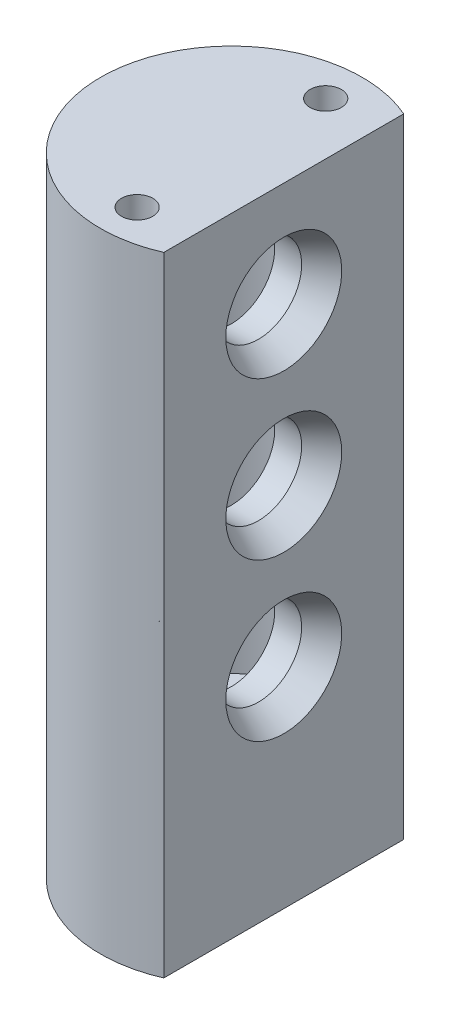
SolidWorks part; units mm, degrees
ref_plane "Front Plane" through (0, 0, 0) normal (0, 0, 1) x (1, 0, 0)
ref_plane "Top Plane" through (0, 0, 0) normal (0, 1, 0) x (1, 0, 0)
ref_plane "Right Plane" through (0, 0, 0) normal (1, 0, 0) x (0, 0, -1)
sketch "Sketch1" plane through (0, 0, 0) normal (0, 1, 0) x (1, 0, 0)
  line L0 (6.35, -14.5497) -> (6.35, 14.5497)
  circle A0 centre (0, 0) radius 16.5227 construction
  arc A1 (6.35, 14.5497) -> (6.35, -14.5497) centre (0, 0) ccw
  dimension "D1" = 33.0454
  dimension "D2" = 31.75
  dimension "D3" = 6.35
extrude "Boss-Extrude1" add sketch "Sketch1" along normal blind 76.2
ref_plane "Plane1" through (0, 15.24, 0) normal (0, 1, 0) x (1, 0, 0)
sketch "Sketch4" plane through (0, 15.24, 0) normal (0, 1, 0) x (1, 0, 0)
  line L0 (0, -8.89) -> (0, 8.89)
  arc A0 (0, 8.89) -> (0, -8.89) centre (0, 0) ccw
  dimension "D1" = 17.78
extrude "Cut-Extrude1" cut sketch "Sketch4" along normal blind 55.88
hole_wizard "M12x1.5 Tapped Hole1" positions "Sketch3" profile "Sketch2" tap size "M12x1.5" standard "ANSI Metric"
sketch "Sketch3" plane through (6.35, 0, 0) normal (1, 0, 0) x (0, 0, -1)
  line L0 (-14.5497, 76.2) -> (14.5497, 76.2) construction
  line L1 (0, 0) -> (0, 76.2) construction
  line L2 (-14.5497, 0) -> (14.5497, 0) construction
  point P0 (0, 63.5)
  point P2 (0, 44.45)
  point P4 (0, 63.5)
  point P8 (0, 76.2)
  point P25 (0, 25.4)
  dimension "D1" = 12.7
  dimension "D2" = 19.05
  dimension "D3" = 19.05
sketch "Sketch2" plane through (6.35, 63.5, 0) normal (0, 1, 0) x (0, 0, -1)
  line L0 (0, 0) -> (0, 22.225)
  line L1 (0, 22.225) -> (5.25, 22.225)
  line L2 (5.25, 22.225) -> (5.25, 0)
  line L5 (5.25, 0) -> (0, 0)
  line L11 (0, -6.35) -> (0, 107.95) construction
  dimension "Thru Tap Drill Dia." = 10.5
  dimension "Thru Tap Drill Depth" = 22.225
sketch "Sketch5" plane through (0, 0, 0) normal (0, 0, 1) x (1, 0, 0)
  line L0 (-12.4648, 72.39) -> (-12.4648, 13.97)
  line L1 (-11.1948, 12.7) -> (-1.27, 12.7)
  line L2 (-11.1948, 73.66) -> (-7.3848, 73.66)
  line L3 (-6.1148, 72.39) -> (-6.1148, 71.12)
  line L6 (0, 0) -> (0, 63.609) construction
  line L7 (0, 15.24) -> (-8.89, 15.24) construction
  line L8 (0, 10.0024) -> (0, 11.43)
  arc A0 (-11.1948, 12.7) -> (-12.4648, 13.97) centre (-11.1948, 13.97) cw
  arc A1 (-12.4648, 72.39) -> (-11.1948, 73.66) centre (-11.1948, 72.39) cw
  arc A2 (-6.1148, 72.39) -> (-7.3848, 73.66) centre (-7.3848, 72.39) ccw
  arc A3 (0, 11.43) -> (-1.27, 12.7) centre (-1.27, 11.43) ccw
  point P8 (-6.1148, 73.66)
  point P14 (-2.5135, 64.77)
  point P23 (0, 12.7)
  dimension "D2" = 1.27
  dimension "D4" = 1.27
  dimension "D6" = 1.27
  dimension "D1" = 2.54
  dimension "D3" = 2.54
  dimension "D5" = 5.08
  dimension "D7" = 58.42
ref_plane "Plane5" through (0, 71.12, 0) normal (0, -1, 0) x (-1, 0, 0)
sketch "Sketch8" plane through (0, 71.12, 0) normal (0, -1, 0) x (-1, 0, 0)
  circle A0 centre (6.1148, 0) radius 0.889
  point P0 (6.1148, 0)
  point P4 (6.1148, 0)
  dimension "D1" = 1.778
sweep "Cut-Sweep1" cut profiles "Sketch8" path "Sketch5"
sketch "Sketch12" plane through (0, 0, 0) normal (0, -1, 0) x (1, 0, 0)
  circle A0 centre (0, 0) radius 2.7051
  circle A1 centre (0, 0) radius 0.889 construction
  circle A2 centre (0, 0) radius 0.889 construction
  dimension "D1" = 5.4102
extrude "Cut-Extrude2" cut sketch "Sketch12" against normal blind 10.16
hole_wizard "CBORE for #6 Socket Head Cap Screw1" positions "Sketch11" profile "Sketch9" counterbore size "#6" standard "ANSI Inch"
sketch "Sketch11" plane through (0, 0, 0) normal (0, -1, 0) x (-1, 0, 0)
  line L0 (0, 0) -> (-6.35, 0) construction
  line L1 (-6.35, -14.5497) -> (-6.35, 14.5497) construction
  point P7 (0, -11.43)
  point P9 (0, 11.43)
  dimension "D1" = 11.43
  dimension "D2" = 6.35
sketch "Sketch9" plane through (0, 0, 11.43) normal (1, 0, 0) x (0, 0, -1)
  line L0 (0, 0) -> (0, 76.2)
  line L1 (0, 76.2) -> (1.8986, 76.2)
  line L3 (1.8986, 76.2) -> (1.8987, 10.16)
  line L4 (3.5725, 10.16) -> (1.8987, 10.16)
  line L5 (3.5725, 10.16) -> (3.5725, 0.635)
  line L6 (3.5725, 0.635) -> (4.2075, 0)
  line L7 (4.2075, 0) -> (0, 0)
  line L8 (-3.5725, 0.635) -> (-4.2075, 0) construction
  line L11 (0, -6.35) -> (0, 107.95) construction
  dimension "Thru Hole Dia." = 3.7973
  dimension "Thru Hole Depth" = 76.2
  dimension "C'Bore Dia." = 7.145
  dimension "C'Bore Depth" = 10.16
  dimension "Near C'Sink Dia." = 8.415
  dimension "Near C'Sink Angle" = 90
sketch "Sketch13" plane through (0, 71.12, 0) normal (0, -1, 0) x (1, 0, 0)
  circle A1 centre (-6.1148, 0) radius 1.524
  circle A2 centre (-6.1148, 0) radius 0.889 construction
  circle A3 centre (-6.1148, 0) radius 0.889
  dimension "D2" = 3.048
extrude "Boss-Extrude2" add sketch "Sketch13" along normal blind 5.08
chamfer "Chamfer1" distance 1.778 angle 60 3 edges at (6.35, 63.5, -5.25) (6.35, 44.45, -5.25) (6.35, 25.4, -5.25)
